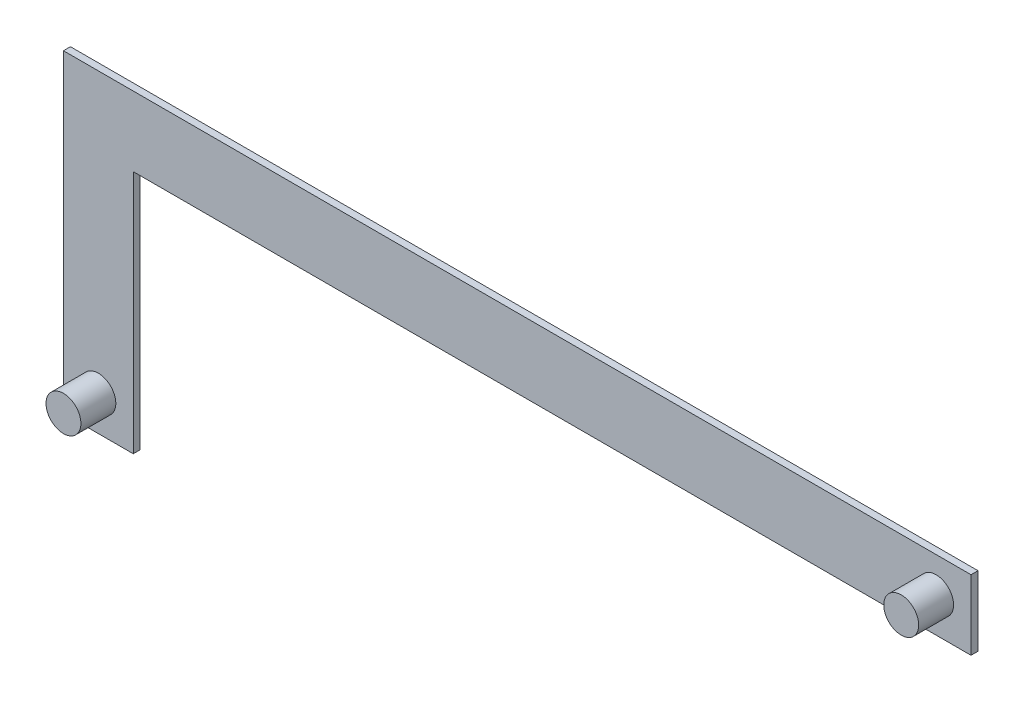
SolidWorks part; units mm, degrees
ref_plane "Front" through (0, 0, 0) normal (0, 0, 1) x (1, 0, 0)
ref_plane "Top" through (0, 0, 0) normal (0, 1, 0) x (1, 0, 0)
ref_plane "Right" through (0, 0, 0) normal (1, 0, 0) x (0, 0, -1)
sketch "Sketch1" plane through (0, 0, 0) normal (0, 0, 1) x (1, 0, 0)
  circle A0 centre (0, 0) radius 2.5
  circle A1 centre (120, 35) radius 2.5
  dimension "D1" = 120
  dimension "D2" = 35
extrude "Extrude1" add sketch "Sketch1" along normal blind 5
sketch "Sketch2" plane through (0, 0, 0) normal (0, 0, -1) x (-1, 0, 0)
  line L0 (-125, 30) -> (-5, 30)
  line L1 (-125, 40) -> (5, 40)
  line L2 (-125, 40) -> (-125, 30)
  line L3 (-5, -5) -> (5, -5)
  line L4 (5, 40) -> (5, -5)
  line L5 (-5, -5) -> (-5, 30)
  circle A0 centre (-120, 35) radius 2.5 construction
  circle A1 centre (0, 0) radius 2.5 construction
  dimension "D1" = 5
  dimension "D2" = 5
  dimension "D3" = 5
  dimension "D4" = 5
  dimension "D5" = 5
  dimension "D6" = 5
extrude "Extrude2" add sketch "Sketch2" along normal blind 1
